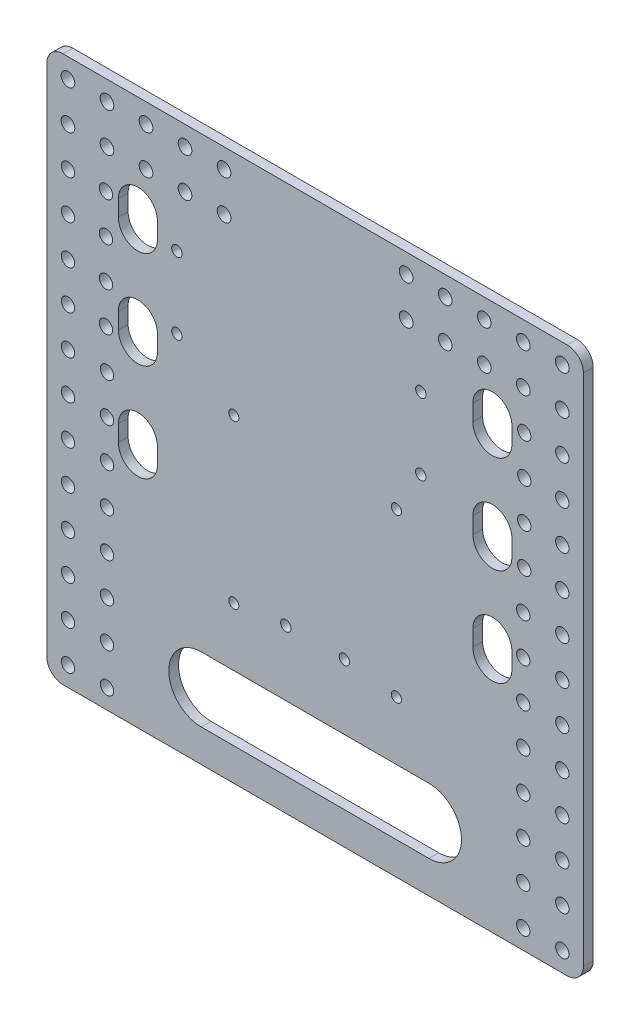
SolidWorks part; units mm, degrees
ref_plane "前视基准面" through (0, 0, 0) normal (0, 0, 1) x (1, 0, 0)
ref_plane "上视基准面" through (0, 0, 0) normal (0, 1, 0) x (1, 0, 0)
ref_plane "右视基准面" through (0, 0, 0) normal (1, 0, 0) x (0, 0, -1)
sketch "草图1" plane through (0, 0, 0) normal (0, 0, 1) x (1, 0, 0)
  line L0 (-421.3386, 0) -> (441.7259, 0) construction
  line L1 (0, 427.568) -> (0, -457.0164) construction
  line L2 (-70, 224.7956) -> (-70, 182.655) construction
  line L3 (-82.5, -215) -> (82.5, -215)
  line L4 (-82.5, -215) -> (-82.5, 215)
  line L5 (-82.5, 215) -> (82.5, 215)
  line L6 (82.5, -215) -> (82.5, 215)
  line L7 (-82.5, -215) -> (82.5, 215) construction
  line L8 (-82.5, 215) -> (82.5, -215) construction
  line L9 (-98.7333, 200) -> (-47.9143, 200) construction
  circle A0 centre (-70, 200) radius 2.05
  circle A1 centre (-70, 185) radius 2.05
  circle A2 centre (70, 185) radius 2.05
  circle A3 centre (70, 200) radius 2.05
  circle A4 centre (-70, -185) radius 2.05
  circle A5 centre (-70, -200) radius 2.05
  circle A6 centre (70, -200) radius 2.05
  circle A7 centre (70, -185) radius 2.05
  point P5 (0, 0)
  dimension "D5" = 4.1
  dimension "D6" = 4.1
  dimension "D7" = 15
  dimension "D1" = 165
  dimension "D2" = 430
  dimension "D3" = 15
  dimension "D4" = 12.5
  dimension "D8" = 0
extrude "凸台-拉伸1" add sketch "草图1" along normal blind 3
sketch "草图2" plane through (0, 0, 3) normal (0, 0, 1) x (1, 0, 0)
  line L0 (0, 347.0549) -> (0, -401.2293) construction
  line L1 (-360.8481, 0) -> (355.8343, 0) construction
  line L2 (-43.4458, -43.4458) -> (0, 0) construction
  circle A0 centre (0, 0) radius 29.5 construction
  circle A1 centre (-20.8597, -20.8597) radius 1.6
  circle A2 centre (-20.8597, 20.8597) radius 1.6
  circle A3 centre (20.8597, 20.8597) radius 1.6
  circle A4 centre (20.8597, -20.8597) radius 1.6
  point P19 (0, 0)
  dimension "D1" = 59
  dimension "D3" = 3.2
  dimension "D5" = 20.8597
  dimension "D6" = 20.8597
  dimension "D2" = 45
  dimension "D4" = 4
extrude "切除-拉伸1" cut sketch "草图2" against normal through all both and the other way through all
sketch "草图6" plane through (0, 0, 0) normal (0, 0, -1) x (-1, 0, 0)
  line L0 (-227.0694, 0) -> (202.0465, 0) construction
  line L1 (0, 619.2168) -> (0, -760.7029) construction
  line L2 (-82.5, -215) -> (-82.5, -275)
  line L3 (-82.5, 215) -> (82.5, 215)
  line L4 (-82.5, 215) -> (-82.5, -215)
  line L5 (-82.5, -215) -> (82.5, -215)
  line L6 (82.5, 215) -> (82.5, -215)
  line L7 (-160, 90) -> (160, 90)
  line L8 (-160, 90) -> (-160, -90)
  line L9 (-160, -90) -> (160, -90)
  line L10 (160, 90) -> (160, -90)
  line L11 (-160, 90) -> (160, -90) construction
  line L12 (-160, -90) -> (160, 90) construction
  line L13 (-82.5, -275) -> (-225, -275)
  line L14 (-225, -275) -> (-225, -315)
  line L15 (-225, -315) -> (225, -315)
  line L16 (225, -275) -> (225, -315)
  line L17 (82.5, -275) -> (225, -275)
  line L18 (82.5, -215) -> (82.5, -275)
  line L19 (-82.5, 215) -> (-82.5, 225)
  line L20 (-82.5, 225) -> (-200, 267)
  line L21 (-200, 267) -> (-200, 287)
  line L22 (-200, 287) -> (200, 287)
  line L23 (200, 267) -> (200, 287)
  line L24 (82.5, 225) -> (200, 267)
  line L25 (82.5, 215) -> (82.5, 225)
  point P11 (0, 0)
  point P21 (0, -315)
  point P28 (0, 287)
  dimension "D1" = 180
  dimension "D2" = 320
  dimension "D3" = 450
  dimension "D4" = 400
  dimension "D5" = 40
  dimension "D6" = 60
  dimension "D7" = 72
  dimension "D8" = 10
  dimension "D9" = 20
extrude "凸台-拉伸2" add sketch "草图6" against normal blind 3 contours L3 L25 L24 L23 L22 L21 L20 L19 | L8 L9 L4 L7 | L10 L7 L6 L9 | L18 L5 L2 L13 L14 L15 L16 L17
fillet "圆角1" radius 60 2 edges at (-82.5, -90, 1.5) (82.5, -90, 1.5)
fillet "圆角2" radius 20 2 edges at (82.5, 225, 1.5) (-82.5, 225, 1.5)
fillet "圆角3" radius 10 8 edges at (200, 267, 1.5) (-200, 267, 1.5) (-200, 287, 1.5) (200, 287, 1.5) (-225, -315, 1.5) (-225, -275, 1.5) (225, -315, 1.5) (225, -275, 1.5)
sketch "草图9" plane through (0, 0, 0) normal (0, 0, -1) x (-1, 0, 0)
  line L0 (0, 378.7393) -> (0, -366.1079) construction
  line L1 (453.619, 0) -> (-417.8729, 0) construction
  circle A0 centre (9, 169) radius 1.6
  circle A1 centre (-9, 169) radius 1.6
  circle A2 centre (-9, -169) radius 1.6
  circle A3 centre (9, -169) radius 1.6
  circle A4 centre (-119, 9) radius 1.6
  circle A5 centre (-119, -9) radius 1.6
  circle A6 centre (119, -9) radius 1.6
  circle A7 centre (119, 9) radius 1.6
  dimension "D1" = 3.2
  dimension "D2" = 9
  dimension "D3" = 338
  dimension "D4" = 3.2
  dimension "D5" = 9
  dimension "D6" = 119
extrude "切除-拉伸6" cut sketch "草图9" against normal through all both and the other way through all
sketch "草图10" plane through (0, 0, 0) normal (0, 0, -1) x (-1, 0, 0)
  line L0 (0, 401.4987) -> (0, -411.1621) construction
  line L1 (-190, 287) -> (190, 287) construction
  circle A0 centre (-32.5, 252) radius 1.6
  circle A1 centre (42.5, 252) radius 1.6
  circle A2 centre (-32.5, 230) radius 1.6
  circle A3 centre (42.5, 230) radius 1.6
  dimension "D1" = 3.2
  dimension "D2" = 35
  dimension "D3" = 32.5
  dimension "D5" = 32.5
  dimension "D6" = 22
  dimension "D4" = 2
  dimension "D7" = 2
extrude "切除-拉伸7" cut sketch "草图10" against normal through all both and the other way through all
sketch "草图11" plane through (0, 0, 0) normal (0, 0, -1) x (-1, 0, 0)
  line L0 (-240.8833, 0) -> (241.6194, 0) construction
  line L1 (-70, 400.9007) -> (-70, -322.8007) construction
  line L2 (-60, 13.8882) -> (-60, -20.7957) construction
  line L3 (0, -540.0334) -> (0, 534.218) construction
  line L4 (60, 13.8882) -> (60, -20.7957) construction
  circle A0 centre (-67.5, 7.5) radius 1.6
  circle A1 centre (-52.5, 7.5) radius 1.6
  circle A2 centre (-52.5, -7.5) radius 1.6
  circle A3 centre (-67.5, -7.5) radius 1.6
  circle A4 centre (67.5, -7.5) radius 1.6
  circle A5 centre (52.5, -7.5) radius 1.6
  circle A6 centre (52.5, 7.5) radius 1.6
  circle A7 centre (67.5, 7.5) radius 1.6
  dimension "D3" = 3.2
  dimension "D4" = 7.5
  dimension "D5" = 7.5
  dimension "D1" = 70
  dimension "D2" = 10
extrude "切除-拉伸8" cut sketch "草图11" against normal through all both and the other way through all
sketch "草图12" plane through (0, 0, 0) normal (0, 0, -1) x (-1, 0, 0)
  line L0 (-297.0189, 0) -> (244.4648, 0) construction
  line L1 (0, 398.3573) -> (0, -359.0878) construction
  line L2 (-160, 90) -> (-160, -90) construction
  circle A0 centre (-120, 35.79) radius 1.6
  circle A1 centre (-120, -35.79) radius 1.6
  circle A2 centre (-91.55, 35.79) radius 1.6
  circle A3 centre (-91.55, -35.79) radius 1.6
  dimension "D1" = 3.2
  dimension "D2" = 35.79
  dimension "D4" = 40
  dimension "D5" = 28.45
  dimension "D6" = 35.79
  dimension "D3" = 2
extrude "切除-拉伸9" [suppressed] cut sketch "草图12" against normal through all both and the other way through all
fillet "圆角4" radius 30 4 edges at (160, -90, 1.5) (160, 90, 1.5) (-160, -90, 1.5) (-160, 90, 1.5)
sketch "草图13" plane through (0, 0, 3) normal (0, 0, 1) x (1, 0, 0)
  line L0 (-277.8952, 0) -> (259.9137, 0) construction
  line L1 (0, 338.1615) -> (0, -323.8829) construction
  line L2 (0, 55) -> (0, 85) construction
  line L3 (-98.826, 70) -> (91.3151, 70) construction
  circle A0 centre (0, 70) radius 12.5
  circle A1 centre (9, 169) radius 1.6 construction
  circle A4 centre (-20, 70) radius 2.1
  circle A5 centre (20, 70) radius 2.1
  point P7 (0, 70)
  dimension "D6" = 25
  dimension "D7" = 99
  dimension "D8" = 4.2
  dimension "D9" = 20
  dimension "D3" = 70
extrude "切除-拉伸10" cut sketch "草图13" against normal through all both and the other way through all
sketch "草图14" plane through (0, 0, 3) normal (0, 0, 1) x (1, 0, 0)
  line L0 (0, 413.2292) -> (0, -453.9607) construction
  line L1 (-225.2126, 0) -> (210.9363, 0) construction
  line L2 (97.5, 10) -> (97.5, -10) construction
  line L3 (-82.5, 150) -> (82.5, 150) construction
  line L4 (-82.5, 150) -> (-82.5, -150) construction
  line L5 (-82.5, -150) -> (82.5, -150) construction
  line L6 (82.5, 150) -> (82.5, -150) construction
  line L7 (105.5, 10) -> (105.5, -10)
  line L8 (89.5, 10) -> (89.5, -10)
  line L9 (-97.5, 10) -> (-97.5, -10) construction
  line L10 (-105.5, 10) -> (-105.5, -10)
  line L11 (-89.5, 10) -> (-89.5, -10)
  arc A0 (105.5, 10) -> (89.5, 10) centre (97.5, 10) ccw
  arc A1 (89.5, -10) -> (105.5, -10) centre (97.5, -10) ccw
  arc A2 (-105.5, 10) -> (-89.5, 10) centre (-97.5, 10) cw
  arc A3 (-89.5, -10) -> (-105.5, -10) centre (-97.5, -10) cw
  point P13 (97.5, 0)
  point P20 (-97.5, 0)
  dimension "D1" = 8
  dimension "D2" = 20
  dimension "D3" = 15
extrude "切除-拉伸11" cut sketch "草图14" against normal through all both and the other way through all
sketch "草图15" plane through (0, 0, 3) normal (0, 0, 1) x (1, 0, 0)
  line L0 (0, 338.1615) -> (0, -332.0563) construction
  line L1 (-295.0593, 0) -> (246.8363, 0) construction
  line L2 (-160, 60) -> (-160, -60.8723) construction
  circle A0 centre (-140, 39.5) radius 1.6
  circle A1 centre (-98, 39.5) radius 1.6
  circle A2 centre (-98, -39.5) radius 1.6
  circle A3 centre (-140, -39.5) radius 1.6
  dimension "D1" = 3.2
  dimension "D2" = 39.5
  dimension "D4" = 20
  dimension "D5" = 39.5
  dimension "D6" = 42
  dimension "D3" = 2
extrude "切除-拉伸12" [suppressed] cut sketch "草图15" against normal through all both and the other way through all
sketch "草图16" plane through (0, 0, 3) normal (0, 0, 1) x (1, 0, 0)
  line L0 (0, 287) -> (0, 0) construction
  line L1 (190, 287) -> (-190, 287) construction
  line L2 (215, -315) -> (-215, -315) construction
  circle A0 centre (-45, -75) radius 1.55
  circle A1 centre (45, -75) radius 1.55
  circle A2 centre (45, -175) radius 1.55
  circle A3 centre (-45, -175) radius 1.55
  dimension "D1" = 3.1
  dimension "D2" = 90
  dimension "D3" = 2
  dimension "D5" = 140
  dimension "D4" = 2
extrude "切除-拉伸13" cut sketch "草图16" against normal blind 10
sketch "草图17" plane through (0, 0, 3) normal (0, 0, 1) x (1, 0, 0)
  line L0 (0, 287) -> (0, -367.0095) construction
  line L1 (190, 287) -> (-190, 287) construction
  line L2 (215, -315) -> (-215, -315) construction
  line L3 (-160, -0.4361) -> (160, -0.4361) construction
  line L4 (-160, 60) -> (-160, -60.8723) construction
  line L5 (160, 60) -> (160, -60.8723) construction
  circle A0 centre (-25, 217) radius 1.55
  circle A1 centre (25, 217) radius 1.55
  circle A2 centre (25, 167) radius 1.55
  circle A3 centre (-25, 167) radius 1.55
  circle A4 centre (-47.5, -255) radius 2.05
  circle A5 centre (47.5, -255) radius 2.05
  circle A6 centre (47.5, -230) radius 2.05
  circle A7 centre (-47.5, -230) radius 2.05
  circle A8 centre (-150, 47.0639) radius 2.05
  circle A9 centre (-125, 47.0639) radius 2.05
  circle A10 centre (-125, -47.9361) radius 2.05
  circle A11 centre (-150, -47.9361) radius 2.05
  circle A12 centre (125, -47.9361) radius 2.05
  circle A13 centre (150, -47.9361) radius 2.05
  circle A14 centre (150, 47.0639) radius 2.05
  circle A15 centre (125, 47.0639) radius 2.05
  circle A16 centre (-70, 185) radius 2.05 construction
  circle A18 centre (70, 175) radius 2.05
  circle A19 centre (70, 160) radius 2.05
  circle A20 centre (-70, 160) radius 2.05
  circle A21 centre (-70, 175) radius 2.05
  dimension "D1" = 3.1
  dimension "D2" = 70
  dimension "D3" = 50
  dimension "D4" = 2
  dimension "D6" = 4.1
  dimension "D7" = 95
  dimension "D8" = 60
  dimension "D9" = 2
  dimension "D11" = 95
  dimension "D12" = 4.1
  dimension "D13" = 10
  dimension "D16" = 0
  dimension "D17" = 0
  dimension "D5" = 2
  dimension "D10" = 2
  dimension "D14" = 2
  dimension "D15" = 2
extrude "切除-拉伸14" cut sketch "草图17" against normal blind 10
sketch "草图18" plane through (0, 0, 3) normal (0, 0, 1) x (1, 0, 0)
  line L0 (0, -315) -> (0, 0) construction
  line L1 (215, -315) -> (-215, -315) construction
  line L2 (-100, -315) -> (100, -315)
  line L3 (100, -315) -> (71.1325, -265)
  line L4 (71.1325, -265) -> (-71.1325, -265)
  line L5 (-100, -315) -> (-71.1325, -265)
  point P10 (0, -265)
  dimension "D1" = 200
  dimension "D2" = 50
  dimension "D3" = 60
extrude "切除-拉伸15" cut sketch "草图18" against normal blind 10
fillet "圆角5" radius 20 4 edges at (100, -315, 1.5) (71.1325, -265, 1.5) (-71.1325, -265, 1.5) (-100, -315, 1.5)
fillet "圆角6" radius 70 2 edges at (82.5, -275, 1.5) (-82.5, -275, 1.5)
sketch "草图19" plane through (0, 0, 3) normal (0, 0, 1) x (1, 0, 0)
  line L0 (0, 70) -> (0, -24.3383) construction
  line L1 (160, 60) -> (160, -60.8723) construction
  circle A0 centre (51.8, -12.8) radius 1.35
  circle A1 centre (0, 70) radius 12.5 construction
  circle A2 centre (-51.8, -12.8) radius 1.35
  circle A3 centre (-51.8, 90.8) radius 1.35
  circle A4 centre (51.8, 90.8) radius 1.35
  dimension "D1" = 2.7
  dimension "D2" = 82.8
  dimension "D3" = 108.2
  dimension "D4" = 2
  dimension "D5" = 2
extrude "切除-拉伸17" cut sketch "草图19" against normal blind 64
sketch "草图20" plane through (0, 0, 0) normal (0, 0, -1) x (-1, 0, 0)
  line L0 (0, 0) -> (0, -311.1921) construction
  line L1 (59.5855, -265) -> (-59.5855, -265) construction
  line L2 (-75, 45) -> (75, 45)
  line L3 (-75, 45) -> (-75, -55)
  line L4 (-75, -55) -> (75, -55)
  line L5 (75, 45) -> (75, -55)
  line L6 (-75, 45) -> (75, -55) construction
  line L7 (-75, -55) -> (75, 45) construction
  point P3 (0, -5)
  dimension "D1" = 150
  dimension "D2" = 210
  dimension "D3" = 100
extrude "切除-拉伸18" cut sketch "草图20" against normal blind 64
sketch "草图21" plane through (0, 0, 0) normal (0, 0, -1) x (-1, 0, 0)
  line L0 (-134.1892, -182) -> (163.3118, -182) construction
  line L1 (0, -265) -> (0, -184.8859) construction
  line L2 (59.5855, -265) -> (-59.5855, -265) construction
  line L6 (-68.3759, -202.5) -> (66.2302, -202.5) construction
  circle A2 centre (-10, -196.5) radius 2.05
  circle A3 centre (10, -196.5) radius 2.05
  circle A4 centre (10, -208.5) radius 2.05
  circle A5 centre (-10, -208.5) radius 2.05
  dimension "D6" = 4.1
  dimension "D7" = 20
  dimension "D8" = 12
  dimension "D9" = 2
  dimension "D4" = 83
  dimension "D10" = 2
extrude "切除-拉伸19" cut sketch "草图21" against normal blind 10
sketch "草图22" plane through (0, 0, 3) normal (0, 0, 1) x (1, 0, 0)
  line L0 (-82.5, 215.5) -> (82.5, 215.5) construction
  line L1 (-82.5, 210.9096) -> (-82.5, 90) construction
  line L2 (82.5, 90) -> (82.5, 210.9096) construction
  line L3 (-70, 200) -> (-70, 232.5781) construction
  line L4 (0, 287) -> (0, 0) construction
  line L5 (190, 287) -> (-190, 287) construction
  circle A0 centre (-70, 200) radius 2.05 construction
  circle A1 centre (-76, 209) radius 2.05
  circle A2 centre (-64, 209) radius 2.05
  circle A3 centre (76, 209) radius 2.05
  circle A4 centre (64, 209) radius 2.05
  circle A5 centre (-76, 197) radius 2.05
  circle A6 centre (-64, 197) radius 2.05
  circle A7 centre (64, 197) radius 2.05
  circle A8 centre (76, 197) radius 2.05
  circle A9 centre (-76, 185) radius 2.05
  circle A10 centre (-64, 185) radius 2.05
  circle A11 centre (64, 185) radius 2.05
  circle A12 centre (76, 185) radius 2.05
  circle A13 centre (-76, 173) radius 2.05
  circle A14 centre (-64, 173) radius 2.05
  circle A15 centre (64, 173) radius 2.05
  circle A16 centre (76, 173) radius 2.05
  circle A17 centre (-76, 161) radius 2.05
  circle A18 centre (-64, 161) radius 2.05
  circle A19 centre (64, 161) radius 2.05
  circle A20 centre (76, 161) radius 2.05
  circle A21 centre (-76, 149) radius 2.05
  circle A22 centre (-64, 149) radius 2.05
  circle A23 centre (64, 149) radius 2.05
  circle A24 centre (76, 149) radius 2.05
  circle A25 centre (-76, 137) radius 2.05
  circle A26 centre (-64, 137) radius 2.05
  circle A27 centre (64, 137) radius 2.05
  circle A28 centre (76, 137) radius 2.05
  circle A29 centre (-76, 125) radius 2.05
  circle A30 centre (-64, 125) radius 2.05
  circle A31 centre (64, 125) radius 2.05
  circle A32 centre (76, 125) radius 2.05
  dimension "D1" = 15.5
  dimension "D2" = 4.1
  dimension "D3" = 6.5
  dimension "D4" = 12
  dimension "D5" = 8
extrude "切除-拉伸20" cut sketch "草图22" against normal blind 10
sketch "草图23" plane through (0, 0, 3) normal (0, 0, 1) x (1, 0, 0)
  circle A0 centre (70, 200) radius 2.05 construction
  circle A1 centre (70, 185) radius 2.05 construction
  circle A2 centre (70, 175) radius 2.05 construction
  circle A3 centre (70, 160) radius 2.05 construction
  circle A4 centre (-70, 160) radius 2.05 construction
  circle A5 centre (-70, 175) radius 2.05 construction
  circle A6 centre (-70, 185) radius 2.05 construction
  circle A7 centre (-70, 200) radius 2.05 construction
  circle A8 centre (70, 200) radius 2.05
  circle A9 centre (70, 185) radius 2.05
  circle A10 centre (70, 175) radius 2.05
  circle A11 centre (70, 160) radius 2.05
  circle A12 centre (-70, 160) radius 2.05
  circle A13 centre (-70, 175) radius 2.05
  circle A14 centre (-70, 185) radius 2.05
  circle A15 centre (-70, 200) radius 2.05
extrude "凸台-拉伸3" add sketch "草图23" against normal up to surface (3 mm away)
sketch "草图24" plane through (0, 0, 3) normal (0, 0, 1) x (1, 0, 0)
  line L1 (-293.6153, 119) -> (291.1887, 119)
  line L2 (-293.6153, 119) -> (-293.6153, -349.3285)
  line L3 (-293.6153, -349.3285) -> (291.1887, -349.3285)
  line L4 (291.1887, 119) -> (291.1887, -349.3285)
  circle A0 centre (-76, 125) radius 2.05 construction
  dimension "D1" = 6
extrude "切除-拉伸21" cut sketch "草图24" against normal blind 10
sketch "草图25" plane through (0, 0, 3) normal (0, 0, 1) x (1, 0, 0)
  line L0 (0, 119) -> (0, 287) construction
  line L1 (82.5, 119) -> (-82.5, 119) construction
  line L2 (190, 287) -> (-190, 287) construction
  line L3 (-35, 139) -> (35, 139) construction
  line L4 (-35, 149) -> (35, 149)
  line L5 (-35, 129) -> (35, 129)
  arc A0 (-35, 149) -> (-35, 129) centre (-35, 139) ccw
  arc A1 (35, 129) -> (35, 149) centre (35, 139) ccw
  point P8 (0, 139)
  dimension "D3" = 10
  dimension "D1" = 70
  dimension "D2" = 35
  dimension "D4" = 20
extrude "切除-拉伸22" cut sketch "草图25" against normal blind 10
sketch "草图27" plane through (0, 0, 0) normal (0, 0, -1) x (-1, 0, 0)
  line L0 (-190, 287) -> (190, 287) construction
  line L1 (-82.5, 119) -> (82.5, 119)
  line L2 (-82.5, 119) -> (-82.5, 287)
  line L3 (-82.5, 287) -> (82.5, 287)
  line L4 (82.5, 119) -> (82.5, 287)
  line L5 (82.5, 210.9096) -> (82.5, 119) construction
  line L7 (-271.6882, 347.3864) -> (228.3514, 347.3864)
  line L8 (-271.6882, 347.3864) -> (-271.6882, 61.1138)
  line L9 (-271.6882, 61.1138) -> (228.3514, 61.1138)
  line L10 (228.3514, 347.3864) -> (228.3514, 61.1138)
  dimension "D1" = 0
extrude "切除-拉伸24" cut sketch "草图27" against normal blind 10
sketch "草图28" plane through (0, 0, 0) normal (0, 0, -1) x (-1, 0, 0)
  line L0 (-82.5, 287) -> (82.5, 287) construction
  line L1 (-82.5, 119) -> (-82.5, 287) construction
  line L2 (0, 287) -> (0, 119) construction
  line L3 (82.5, 119) -> (-82.5, 119) construction
  circle A0 centre (-76, 281) radius 2.1
  circle A1 centre (-64, 281) radius 2.1
  circle A2 centre (-52, 281) radius 2.1
  circle A3 centre (-64, 269) radius 2.1
  circle A4 centre (-52, 269) radius 2.1
  circle A5 centre (-76, 269) radius 2.1
  circle A6 centre (-40, 281) radius 2.1
  circle A7 centre (-28, 281) radius 2.1
  circle A8 centre (-40, 269) radius 2.1
  circle A9 centre (28, 269) radius 2.1
  circle A10 centre (40, 269) radius 2.1
  circle A11 centre (28, 281) radius 2.1
  circle A12 centre (40, 281) radius 2.1
  circle A13 centre (76, 269) radius 2.1
  circle A14 centre (52, 269) radius 2.1
  circle A15 centre (64, 269) radius 2.1
  circle A16 centre (52, 281) radius 2.1
  circle A17 centre (64, 281) radius 2.1
  circle A18 centre (-28, 269) radius 2.1
  circle A19 centre (76, 281) radius 2.1
  dimension "D1" = 4.2
  dimension "D2" = 5
  dimension "D4" = 6
  dimension "D5" = 6.5
  dimension "D3" = 2
extrude "切除-拉伸25" cut sketch "草图28" against normal blind 10
sketch "草图31" plane through (0, 0, 3) normal (0, 0, 1) x (1, 0, 0)
  line L0 (-82.5, 287) -> (-82.5, 119) construction
  line L1 (0, 287) -> (0, 119) construction
  line L2 (82.5, 287) -> (-82.5, 287) construction
  line L3 (82.5, 119) -> (-82.5, 119) construction
  circle A0 centre (-76, 221) radius 2.05
  circle A1 centre (-64.3039, 220.9962) radius 2.05
  circle A3 centre (-76, 209) radius 2.05 construction
  circle A4 centre (-64, 209) radius 2.05 construction
  circle A5 centre (-76, 233) radius 2.05
  circle A6 centre (-64.3039, 232.9962) radius 2.05
  circle A7 centre (-76, 245) radius 2.05
  circle A8 centre (-64.3039, 244.9962) radius 2.05
  circle A9 centre (-76, 257) radius 2.05
  circle A10 centre (-64.3039, 256.9962) radius 2.05
  circle A11 centre (64.3039, 256.9962) radius 2.05
  circle A12 centre (76, 257) radius 2.05
  circle A13 centre (-76, 269) radius 2.05
  circle A14 centre (-64.3039, 268.9962) radius 2.05
  circle A15 centre (64.3039, 244.9962) radius 2.05
  circle A16 centre (76, 245) radius 2.05
  circle A17 centre (64.3039, 232.9962) radius 2.05
  circle A18 centre (76, 233) radius 2.05
  circle A19 centre (64.3039, 220.9962) radius 2.05
  circle A20 centre (76, 221) radius 2.05
  dimension "D1" = 4.1
  dimension "D2" = 4.1
  dimension "D3" = 12
  dimension "D4" = 12
  dimension "D6" = 6.5
  dimension "D5" = 5
extrude "切除-拉伸28" cut sketch "草图31" against normal blind 10
sketch "草图32" plane through (0, 0, 0) normal (0, 0, -1) x (-1, 0, 0)
  line L0 (-54.5, 257) -> (-54.5, 252) construction
  line L1 (-48.5, 257) -> (-48.5, 252)
  line L2 (-60.5, 257) -> (-60.5, 252)
  line L3 (-82.5, 119) -> (-82.5, 287) construction
  line L4 (-82.5, 287) -> (82.5, 287) construction
  line L5 (0, 287) -> (0, 119) construction
  line L6 (82.5, 119) -> (-82.5, 119) construction
  line L7 (54.5, 257) -> (54.5, 252) construction
  line L8 (48.5, 257) -> (48.5, 252)
  line L9 (60.5, 257) -> (60.5, 252)
  line L10 (0, 257) -> (0, 89) construction
  line L11 (-54.5, 227) -> (-54.5, 222) construction
  line L12 (-48.5, 227) -> (-48.5, 222)
  line L13 (-60.5, 227) -> (-60.5, 222)
  line L14 (54.5, 227) -> (54.5, 222) construction
  line L15 (48.5, 227) -> (48.5, 222)
  line L16 (60.5, 227) -> (60.5, 222)
  line L17 (0, 227) -> (0, 59) construction
  line L18 (-54.5, 197) -> (-54.5, 192) construction
  line L19 (-48.5, 197) -> (-48.5, 192)
  line L20 (-60.5, 197) -> (-60.5, 192)
  line L21 (54.5, 197) -> (54.5, 192) construction
  line L22 (48.5, 197) -> (48.5, 192)
  line L23 (60.5, 197) -> (60.5, 192)
  arc A0 (-48.5, 257) -> (-60.5, 257) centre (-54.5, 257) ccw
  arc A1 (-60.5, 252) -> (-48.5, 252) centre (-54.5, 252) ccw
  arc A2 (48.5, 257) -> (60.5, 257) centre (54.5, 257) cw
  arc A3 (60.5, 252) -> (48.5, 252) centre (54.5, 252) cw
  arc A4 (-48.5, 227) -> (-60.5, 227) centre (-54.5, 227) ccw
  arc A5 (-60.5, 222) -> (-48.5, 222) centre (-54.5, 222) ccw
  arc A6 (48.5, 227) -> (60.5, 227) centre (54.5, 227) cw
  arc A7 (60.5, 222) -> (48.5, 222) centre (54.5, 222) cw
  arc A8 (-48.5, 197) -> (-60.5, 197) centre (-54.5, 197) ccw
  arc A9 (-60.5, 192) -> (-48.5, 192) centre (-54.5, 192) ccw
  arc A10 (48.5, 197) -> (60.5, 197) centre (54.5, 197) cw
  arc A11 (60.5, 192) -> (48.5, 192) centre (54.5, 192) cw
  point P2 (-54.5, 254.5)
  point P17 (54.5, 254.5)
  point P25 (-54.5, 224.5)
  point P34 (54.5, 224.5)
  point P41 (-54.5, 194.5)
  point P50 (54.5, 194.5)
  dimension "D1" = 6
  dimension "D3" = 30
  dimension "D2" = 28
  dimension "D4" = 5
  dimension "D5" = 3
extrude "切除-拉伸29" cut sketch "草图32" against normal blind 10
fillet "圆角7" radius 5 4 edges at (82.5, 287, 1.5) (-82.5, 287, 1.5) (-82.5, 119, 1.5) (82.5, 119, 1.5)
